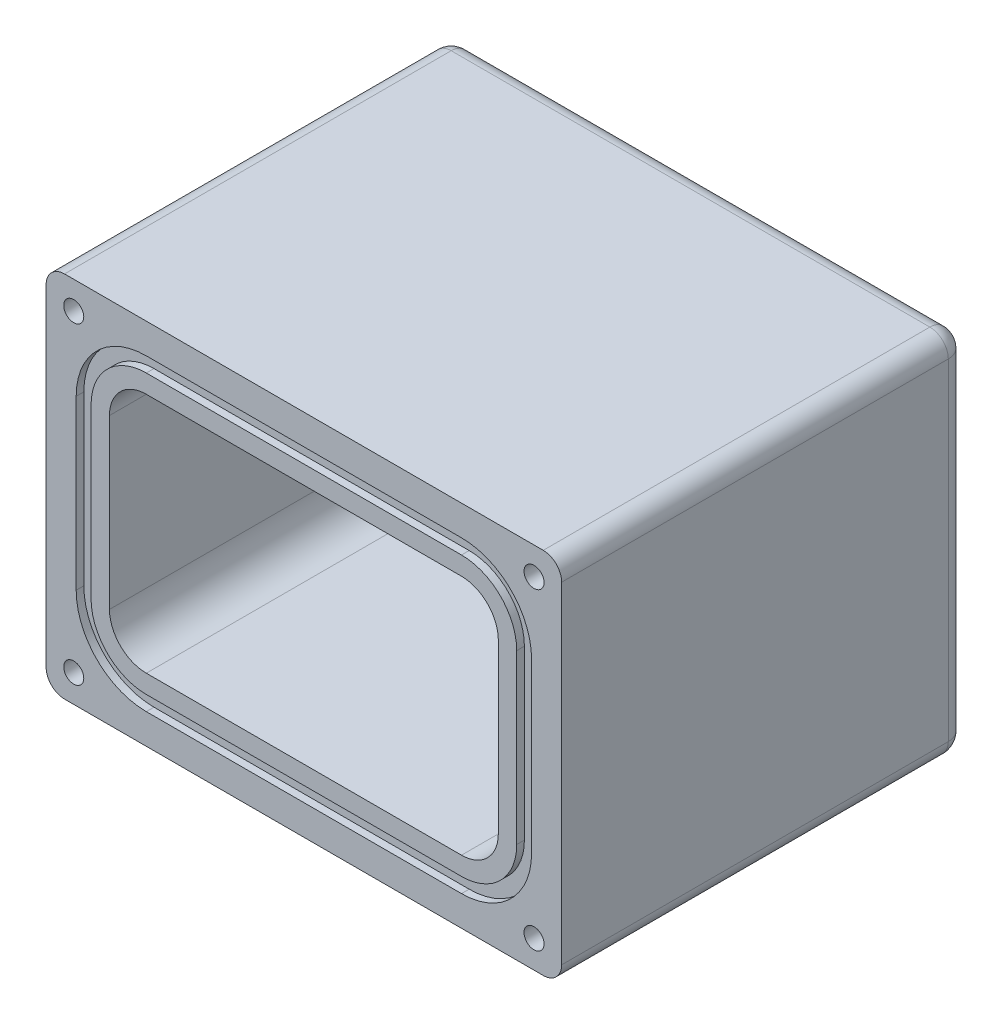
SolidWorks part; units mm, degrees
ref_plane "Front" through (0, 0, 0) normal (0, 0, 1) x (1, 0, 0)
ref_plane "Top" through (0, 0, 0) normal (0, 1, 0) x (1, 0, 0)
ref_plane "Right" through (0, 0, 0) normal (1, 0, 0) x (0, 0, -1)
sketch "Sketch1" plane through (0, 0, 0) normal (0, 0, 1) x (1, 0, 0)
  line L1 (-44.45, -31.75) -> (44.45, -31.75)
  line L2 (-44.45, -31.75) -> (-44.45, 31.75)
  line L3 (-44.45, 31.75) -> (44.45, 31.75)
  line L4 (44.45, -31.75) -> (44.45, 31.75)
  line L10 (0, -31.75) -> (0, 0) construction
  line L11 (0, 0) -> (-44.45, 0) construction
  dimension "D3" = 88.9
  dimension "D4" = 63.5
extrude "Boss-Extrude1" add sketch "Sketch1" along normal blind 69.85
sketch "Sketch2" plane through (0, 0, 69.85) normal (0, 0, 1) x (1, 0, 0)
  line L0 (0, 0) -> (0, 20.828) construction
  line L1 (-33.528, -20.828) -> (33.528, -20.828)
  line L2 (-33.528, -20.828) -> (-33.528, 20.828)
  line L3 (-33.528, 20.828) -> (33.528, 20.828)
  line L4 (33.528, -20.828) -> (33.528, 20.828)
  line L5 (-33.528, 0) -> (-44.45, 0) construction
  line L6 (0, 0) -> (-33.528, 0) construction
  line L7 (-44.45, 31.75) -> (-44.45, -31.75) construction
  line L8 (0, 20.828) -> (0, 31.75) construction
  line L9 (44.45, 31.75) -> (-44.45, 31.75) construction
  dimension "D2" = 41.656
extrude "Cut-Extrude1" cut sketch "Sketch2" against normal offset from surface (60.96 mm away) 8.89
sketch "Sketch3" plane through (0, 0, 8.89) normal (0, 0, 1) x (1, 0, 0)
  circle A0 centre (-14.3572, 7.0293) radius 11.5189
  dimension "D1" = 23.0378
  dimension "D2" = 14.3572
  dimension "D3" = 7.0293
extrude "Cut-Extrude2" cut sketch "Sketch3" against normal through all
sketch "Sketch4" plane through (0, 0, 0) normal (0, 0, -1) x (-1, 0, 0)
  circle A0 centre (14.3572, 7.0293) radius 15.9131
  circle A1 centre (14.3572, 7.0293) radius 13.3477
  dimension "D1" = 2.5654
  dimension "D2" = 26.6954
extrude "Cut-Extrude3" cut sketch "Sketch4" against normal blind 1.3208
sketch "Sketch6" plane through (0, 0, 69.85) normal (0, 0, 1) x (1, 0, 0)
  line L0 (-27.178, 24.003) -> (27.178, 24.003)
  line L1 (-27.178, 26.5684) -> (27.178, 26.5684)
  line L2 (-39.2684, 14.478) -> (-39.2684, -14.478)
  line L3 (-27.178, -26.5684) -> (27.178, -26.5684)
  line L4 (39.2684, 14.478) -> (39.2684, -14.478)
  line L5 (36.703, 14.478) -> (36.703, -14.478)
  line L6 (-27.178, -24.003) -> (27.178, -24.003)
  line L7 (-36.703, 14.478) -> (-36.703, -14.478)
  line L8 (33.528, 20.828) -> (-33.528, 20.828) construction
  line L9 (-33.528, 20.828) -> (-33.528, -20.828) construction
  line L10 (-33.528, -20.828) -> (33.528, -20.828) construction
  line L11 (33.528, -20.828) -> (33.528, 20.828) construction
  arc A0 (27.178, -26.5684) -> (39.2684, -14.478) centre (27.178, -14.478) ccw
  arc A1 (39.2684, 14.478) -> (27.178, 26.5684) centre (27.178, 14.478) ccw
  arc A2 (-27.178, -26.5684) -> (-39.2684, -14.478) centre (-27.178, -14.478) cw
  arc A3 (-39.2684, 14.478) -> (-27.178, 26.5684) centre (-27.178, 14.478) cw
  arc A4 (36.703, 14.478) -> (27.178, 24.003) centre (27.178, 14.478) ccw
  arc A5 (27.178, -24.003) -> (36.703, -14.478) centre (27.178, -14.478) ccw
  arc A6 (-27.178, -24.003) -> (-36.703, -14.478) centre (-27.178, -14.478) cw
  arc A7 (-36.703, 14.478) -> (-27.178, 24.003) centre (-27.178, 14.478) cw
  dimension "D1" = 9.525
  dimension "D3" = 3.175
  dimension "D4" = 3.175
  dimension "D5" = 3.175
  dimension "D6" = 3.175
  dimension "D2" = 2.5654
extrude "Cut-Extrude4" cut sketch "Sketch6" against normal blind 1.3208
fillet "Fillet1" radius 6.35 4 edges at (-33.528, -20.828, 39.37) (33.528, -20.828, 39.37) (33.528, 20.828, 39.37) (-33.528, 20.828, 39.37)
hole_wizard "#6-32 Tapped Hole1" positions "Sketch8" profile "Sketch7" tap size "#6-32" standard "ANSI Inch"
sketch "Sketch8" plane through (0, 0, 0) normal (0, 0, -1) x (-1, 0, 0)
  line L0 (-7.2328, 7.0293) -> (14.3572, 7.0293) construction
  line L1 (14.3572, 7.0293) -> (35.9472, 7.0293) construction
  point P0 (-7.2328, 7.0293)
  point P2 (35.9472, 7.0293)
  dimension "D1" = 43.18
sketch "Sketch7" plane through (7.2328, 7.0293, 0) normal (1, 0, 0) x (0, 1, 0)
  line L0 (0, 0) -> (0, 7.1627)
  line L1 (0, 7.1627) -> (1.3525, 6.35)
  line L2 (1.3525, 6.35) -> (1.3525, 0)
  line L5 (1.3525, 0) -> (0, 0)
  line L10 (0, 7.1627) -> (-1.3526, 6.35) construction
  line L11 (0, -6.35) -> (0, 107.95) construction
  dimension "Tap Drill Dia." = 2.7051
  dimension "Tap Drill Depth" = 6.35
  dimension "Drill Angle" = 118
fillet "Fillet3" radius 3.175 8 edges at (44.45, 0, 0) (0, -31.75, 0) (-44.45, -31.75, 34.925) (-44.45, 0, 0) (0, 31.75, 0) (-44.45, 31.75, 34.925) (44.45, 31.75, 34.925) (44.45, -31.75, 34.925)
hole_wizard "#8-32 Tapped Hole1" positions "Sketch10" profile "Sketch9" tap size "#8-32" standard "ANSI Inch"
sketch "Sketch10" plane through (0, 0, 69.85) normal (0, 0, 1) x (1, 0, 0)
  line L1 (-39.6875, 26.9875) -> (39.6875, 26.9875)
  line L2 (-39.6875, 26.9875) -> (-39.6875, -26.9875)
  line L3 (-39.6875, -26.9875) -> (39.6875, -26.9875)
  line L4 (39.6875, 26.9875) -> (39.6875, -26.9875)
  line L5 (0, 0) -> (0, 26.9875) construction
  line L8 (0, 0) -> (-39.6875, 0) construction
  line L10 (-44.45, 28.575) -> (-44.45, -28.575) construction
  line L11 (41.275, 31.75) -> (-41.275, 31.75) construction
  point P1 (-39.6875, 26.9875)
  point P2 (39.6875, -26.9875)
  point P227 (-39.6875, -26.9875)
  point P228 (39.6875, 26.9875)
  dimension "D1" = 4.7625
  dimension "D2" = 4.7625
sketch "Sketch9" plane through (-39.6875, 26.9875, 69.85) normal (1, 0, 0) x (0, -1, 0)
  line L0 (0, 0) -> (0, 10.5628)
  line L1 (0, 10.5628) -> (1.7272, 9.525)
  line L2 (1.7272, 9.525) -> (1.7272, 0)
  line L5 (1.7272, 0) -> (0, 0)
  line L10 (0, 10.5628) -> (-1.7272, 9.525) construction
  line L11 (0, -6.35) -> (0, 107.95) construction
  dimension "Tap Drill Dia." = 3.4544
  dimension "Tap Drill Depth" = 9.525
  dimension "Drill Angle" = 118
hole_wizard "#8-32 Tapped Hole2" positions "Sketch12" profile "Sketch11" tap size "#8-32" standard "ANSI Inch"
sketch "Sketch12" plane through (0, -31.75, 0) normal (0, 1, 0) x (1, 0, 0)
  line L1 (-8.128, -48.26) -> (8.128, -48.26)
  line L2 (-8.128, -48.26) -> (-8.128, -57.15)
  line L3 (-8.128, -57.15) -> (8.128, -57.15)
  line L4 (8.128, -48.26) -> (8.128, -57.15)
  line L5 (0, -69.85) -> (0, -57.15) construction
  line L6 (41.275, -69.85) -> (-41.275, -69.85) construction
  point P1 (-8.128, -48.26)
  point P2 (8.128, -57.15)
  point P177 (-8.128, -57.15)
  point P178 (8.128, -48.26)
  dimension "D1" = 12.7
  dimension "D2" = 16.256
  dimension "D3" = 8.89
sketch "Sketch11" plane through (-8.128, -31.75, 48.26) normal (1, 0, 0) x (0, 0, -1)
  line L0 (0, 0) -> (0, 7.3878)
  line L1 (0, 7.3878) -> (1.7272, 6.35)
  line L2 (1.7272, 6.35) -> (1.7272, 0)
  line L5 (1.7272, 0) -> (0, 0)
  line L10 (0, 7.3878) -> (-1.7272, 6.35) construction
  line L11 (0, -6.35) -> (0, 107.95) construction
  dimension "Tap Drill Dia." = 3.4544
  dimension "Tap Drill Depth" = 6.35
  dimension "Drill Angle" = 118
